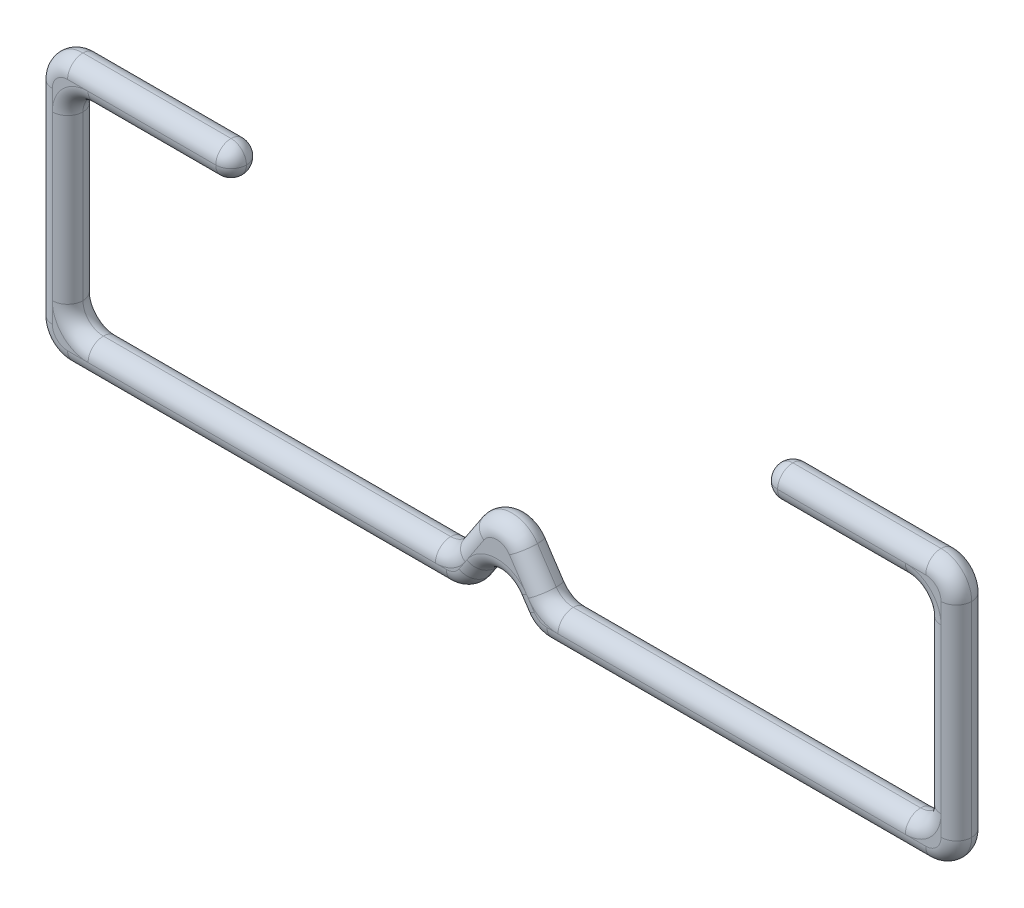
SolidWorks part; units mm, degrees
ref_plane "Plan de face" through (0, 0, 0) normal (0, 0, 1) x (1, 0, 0)
ref_plane "Plan de dessus" through (0, 0, 0) normal (0, 1, 0) x (1, 0, 0)
ref_plane "Plan de droite" through (0, 0, 0) normal (1, 0, 0) x (0, 0, -1)
sketch "Esquisse1" plane through (0, 0, 0) normal (0, 0, 1) x (1, 0, 0)
  line L0 (-9, 4.2) -> (-5.2, 4.2)
  line L1 (-9, 4.2) -> (-9, -1)
  line L2 (-9, -1) -> (-0.6633, -1)
  line L3 (-0.6633, -1) -> (-0.3333, -0.5025)
  line L4 (0.3333, -0.5025) -> (0.6633, -1)
  line L5 (0.6633, -1) -> (9, -1)
  line L6 (9, -1) -> (9, 4.2)
  line L7 (9, 4.2) -> (5.2, 4.2)
  line L8 (5.2, 4.2) -> (5.2, 3.6)
  line L9 (5.2, 3.6) -> (8, 3.6)
  line L10 (8.4, 3.2) -> (8.4, 0)
  line L11 (8, -0.4) -> (1.2, -0.4)
  line L12 (0.8667, -0.2211) -> (0.5, 0.3317)
  line L13 (-0.5, 0.3317) -> (-0.8667, -0.2211)
  line L14 (-8, -0.4) -> (-1.2, -0.4)
  line L15 (-8.4, 0) -> (-8.4, 3.2)
  line L16 (-8, 3.6) -> (-5.2, 3.6)
  line L17 (-5.2, 3.6) -> (-5.2, 4.2)
  line L18 (-9, 3.6) -> (-8.4, 3.6) construction
  line L19 (-8.4, -1) -> (-8.4, -0.4) construction
  line L20 (8.4, 3.6) -> (9, 3.6) construction
  line L21 (8.4, -1) -> (8.4, -0.4) construction
  line L22 (-0.9853, -0.4) -> (-0.4853, -0.7317) construction
  line L23 (0.9853, -0.4) -> (0.4853, -0.7317) construction
  line L24 (0, 0) -> (0, 1.0854)
  arc A0 (-0.8667, -0.2211) -> (-1.2, -0.4) centre (-1.2, 0) cw
  arc A1 (1.2, -0.4) -> (0.8667, -0.2211) centre (1.2, 0) cw
  arc A2 (0.5, 0.3317) -> (-0.5, 0.3317) centre (0, 0) ccw
  arc A3 (-8.4, 3.2) -> (-8, 3.6) centre (-8, 3.2) cw
  arc A4 (-8, -0.4) -> (-8.4, 0) centre (-8, 0) cw
  arc A5 (8.4, 0) -> (8, -0.4) centre (8, 0) cw
  arc A6 (8.4, 3.2) -> (8, 3.6) centre (8, 3.2) ccw
  arc A7 (0.3333, -0.5025) -> (-0.3333, -0.5025) centre (0, -0.7236) ccw
  dimension "D6" = 0.4
  dimension "D7" = 0.6
  dimension "D10" = 0.4
  dimension "D1" = 3.8
  dimension "D2" = 5.2
  dimension "D3" = 0.6
  dimension "D4" = 9
  dimension "D5" = 9
  dimension "D9" = 2.4
extrude "Extrusion1" add sketch "Esquisse1" along normal mid plane 0.6
fillet "Congé1" radius 0.6 6 edges at (9, 4.2, 0) (9, -1, 0) (-0.6633, -1, 0) (0.6633, -1, 0) (-9, -1, 0) (-9, 4.2, 0)
fillet "Congé2" radius 0.3 4 edges at (5.2, 4.2, 0) (5.2, 3.6, 0) (-5.2, 3.6, 0) (-5.2, 4.2, 0)
fillet "Congé3" radius 0.3 68 edges at (6.75, 3.6, -0.3) (8.2828, 3.4828, -0.3) (8.4, 1.6, -0.3) (8.2828, -0.2828, -0.3) (4.6, -0.4, -0.3) (1.0108, -0.3525, -0.3) (0.6833, 0.0553, -0.3) (0, 0.6, -0.3) (-0.6833, 0.0553, -0.3) (-1.0108, -0.3525, -0.3) (-4.6, -0.4, -0.3) (-8.2828, -0.2828, -0.3) (-8.4, 1.6, -0.3) (-8.2828, 3.4828, -0.3) (-6.75, 3.6, -0.3) (-5.2879, 3.6879, -0.3) (-5.2879, 4.1121, -0.3) (-6.95, 4.2, -0.3) (-8.8243, 4.0243, -0.3) (-9, 1.6, -0.3) (-8.8243, -0.8243, -0.3) (-4.6927, -1, -0.3) (-0.7016, -0.9287, -0.3) (-0.4093, -0.6171, -0.3) (0, -0.3236, -0.3) (0.4093, -0.6171, -0.3) (0.7016, -0.9287, -0.3) (4.6927, -1, -0.3) (8.8243, -0.8243, -0.3) (9, 1.6, -0.3) (8.8243, 4.0243, -0.3) (6.95, 4.2, -0.3) (5.2879, 4.1121, -0.3) (5.2879, 3.6879, -0.3) (8.8243, 4.0243, 0.3) (9, 1.6, 0.3) (8.8243, -0.8243, 0.3) (4.6927, -1, 0.3) (0.7016, -0.9287, 0.3) (0.4093, -0.6171, 0.3) (0, -0.3236, 0.3) (-0.4093, -0.6171, 0.3) (-0.7016, -0.9287, 0.3) (-4.6927, -1, 0.3) (-8.8243, -0.8243, 0.3) (-9, 1.6, 0.3) (-8.8243, 4.0243, 0.3) (-6.95, 4.2, 0.3) (-5.2879, 4.1121, 0.3) (-5.2879, 3.6879, 0.3) (-6.75, 3.6, 0.3) (-8.2828, 3.4828, 0.3) (-8.4, 1.6, 0.3) (-8.2828, -0.2828, 0.3) (-4.6, -0.4, 0.3) (-1.0108, -0.3525, 0.3) (-0.6833, 0.0553, 0.3) (0, 0.6, 0.3) (0.6833, 0.0553, 0.3) (1.0108, -0.3525, 0.3) (4.6, -0.4, 0.3) (8.2828, -0.2828, 0.3) (8.4, 1.6, 0.3) (8.2828, 3.4828, 0.3) (6.75, 3.6, 0.3) (5.2879, 3.6879, 0.3) (5.2879, 4.1121, 0.3) (6.95, 4.2, 0.3)
